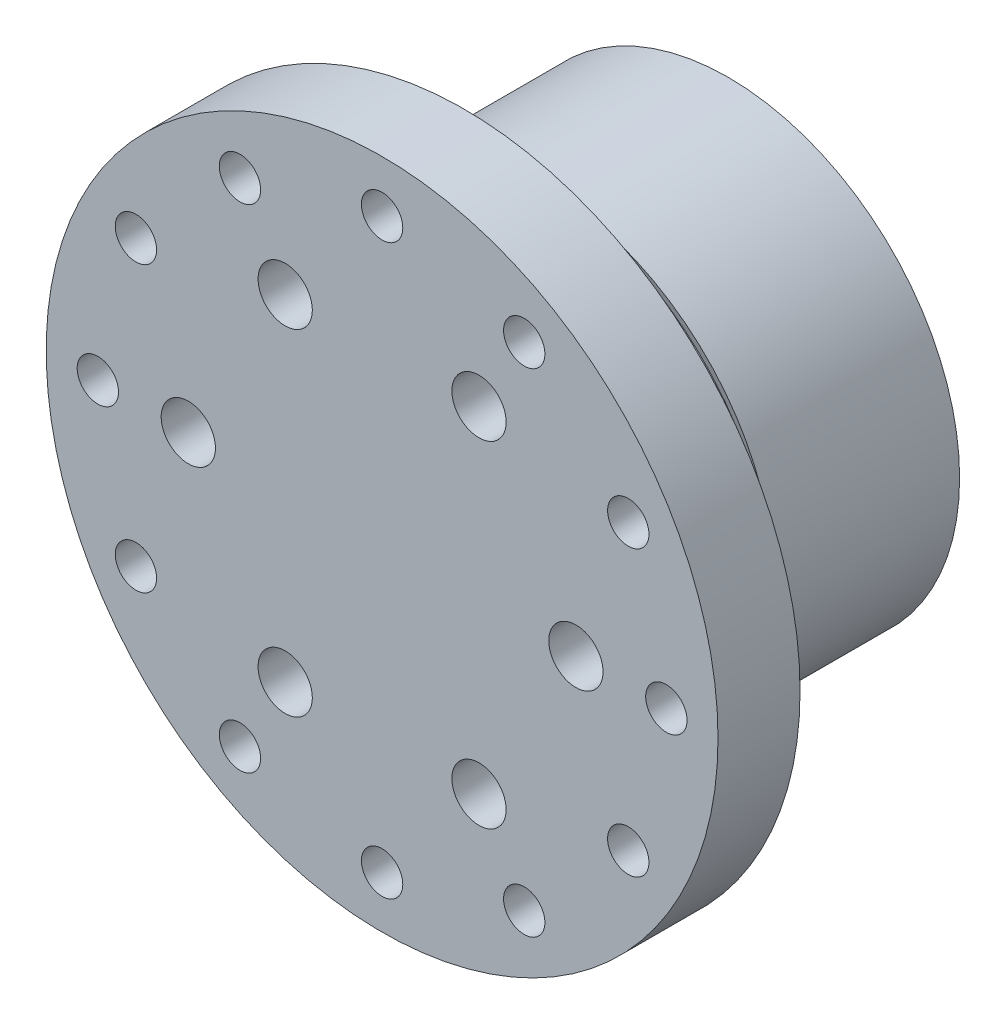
SolidWorks part; units mm, degrees
ref_plane "Front Plane" through (0, 0, 0) normal (1, 0, 0) x (0, 1, 0)
ref_plane "Top Plane" through (0, 0, 0) normal (0, 0, 1) x (0, 1, 0)
ref_plane "Right Plane" through (0, 0, 0) normal (0, 1, 0) x (-1, 0, 0)
sketch "Sketch1" plane through (0, 0, 0) normal (0, 0, 1) x (0, 1, 0)
  circle A0 centre (0, 0) radius 18.9
  dimension "D1" = 37.8
extrude "Boss-Extrude1" add sketch "Sketch1" along normal blind 20.45
sketch "Sketch4" plane through (0, 0, 20.45) normal (0, 0, 1) x (1, 0, 0)
  circle A0 centre (0, 0) radius 26
  dimension "D1" = 52
extrude "Boss-Extrude2" add sketch "Sketch4" along normal blind 6.35
sketch "Sketch2" plane through (0, 0, 26.8) normal (0, 0, 1) x (1, 0, 0)
  line L0 (0, 0) -> (15, 0) construction
  circle A0 centre (15, 0) radius 2.1
  circle A1 centre (7.5, -12.9904) radius 2.1
  circle A2 centre (-7.5, -12.9904) radius 2.1
  circle A3 centre (-15, 0) radius 2.1
  circle A4 centre (-7.5, 12.9904) radius 2.1
  circle A5 centre (7.5, 12.9904) radius 2.1
  dimension "D3" = 4.2
  dimension "D2" = 15
  dimension "D1" = 6
extrude "Cut-Extrude1" cut sketch "Sketch2" against normal through all both and the other way through all
sketch "Sketch3" plane through (0, 0, 0) normal (0, 0, -1) x (1, 0, 0)
  line L0 (0, 0) -> (12.3409, 7.125) construction
  line L1 (0, 0) -> (15, 0) construction
  line L2 (7.5, 12.9904) -> (0, 0) construction
  circle A0 centre (12.3409, 7.125) radius 3
  circle A1 centre (0, -14.25) radius 3
  circle A2 centre (-12.3409, 7.125) radius 3
  dimension "D2" = 6
  dimension "D1" = 14.25
  dimension "D3" = 30
  dimension "D4" = 3
extrude "Cut-Extrude2" cut sketch "Sketch3" against normal blind 4
sketch "Sketch5" plane through (0, 0, 26.8) normal (0, 0, 1) x (1, 0, 0)
  line L0 (0, 0) -> (22, 0) construction
  circle A0 centre (22, 0) radius 1.6
  circle A1 centre (19.0526, -11) radius 1.6
  circle A2 centre (11, -19.0526) radius 1.6
  circle A3 centre (0, -22) radius 1.6
  circle A4 centre (-11, -19.0526) radius 1.6
  circle A5 centre (-19.0526, -11) radius 1.6
  circle A6 centre (-22, 0) radius 1.6
  circle A7 centre (-19.0526, 11) radius 1.6
  circle A8 centre (-11, 19.0526) radius 1.6
  circle A9 centre (0, 22) radius 1.6
  circle A10 centre (11, 19.0526) radius 1.6
  circle A11 centre (19.0526, 11) radius 1.6
  dimension "D2" = 3.2
  dimension "D1" = 22
  dimension "D3" = 12
extrude "Cut-Extrude3" cut sketch "Sketch5" against normal through all
sketch "Sketch6" plane through (0, 0, 0) normal (0, 0, -1) x (1, 0, 0)
  circle A0 centre (0, 0) radius 18.9
  circle A2 centre (0, 0) radius 18.9 construction
  circle A3 centre (0, 0) radius 17.9
  dimension "D1" = 35.8
extrude "Cut-Extrude4" cut sketch "Sketch6" against normal offset from surface (15.35 mm away) 5.1
chamfer "Chamfer1" distance 1 angle 45 1 edges at (17.9, 0, 15.35)
